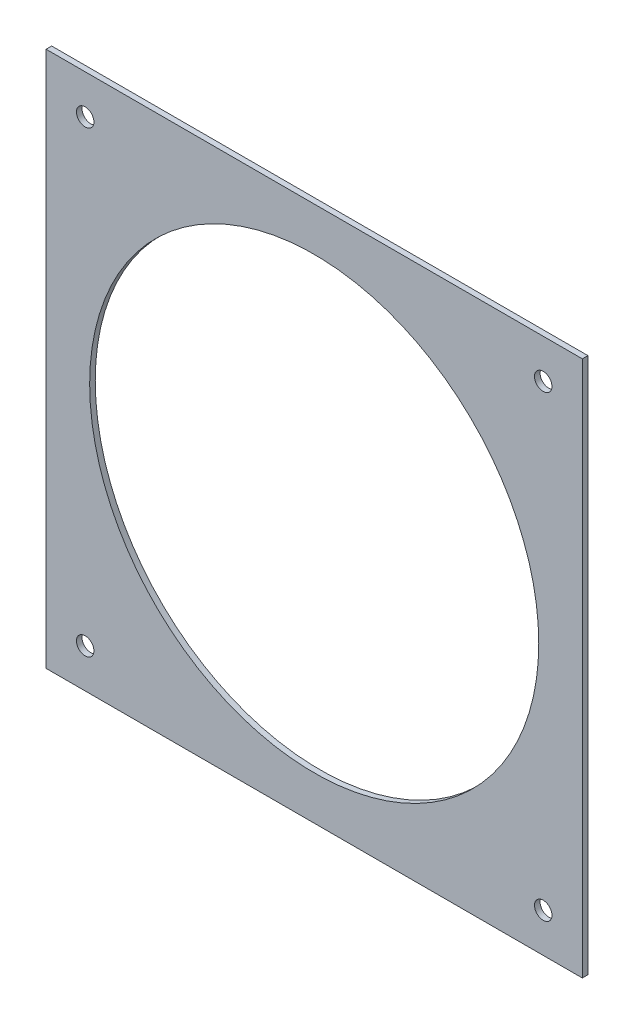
SolidWorks part; units mm, degrees
ref_plane "Front" through (0, 0, 0) normal (0, 0, 1) x (1, 0, 0)
ref_plane "Top" through (0, 0, 0) normal (0, 1, 0) x (1, 0, 0)
ref_plane "Right" through (0, 0, 0) normal (1, 0, 0) x (0, 0, -1)
sketch "Sketch1" plane through (0, 0, 0) normal (0, 0, 1) x (1, 0, 0)
  line L1 (0, 0) -> (304.8, 0)
  line L2 (0, 0) -> (0, 304.8)
  line L3 (0, 304.8) -> (304.8, 304.8)
  line L4 (304.8, 0) -> (304.8, 304.8)
  circle A0 centre (152.4, 152.4) radius 127.635
  dimension "D3" = 255.27
  dimension "D1" = 304.8
  dimension "D2" = 304.8
extrude "Boss-Extrude1" add sketch "Sketch1" along normal blind 3.175
hole_wizard "25/64 (0.39063) Diameter Hole1" positions "Sketch2" profile "Sketch3" hole size "25/64" standard "ANSI Inch"
sketch "Sketch2" plane through (0, 0, 3.175) normal (0, 0, 1) x (1, 0, 0)
  line L0 (0, 304.8) -> (0, 0) construction
  line L1 (0, 0) -> (304.8, 0) construction
  point P0 (22.225, 22.225)
  point P2 (282.575, 22.225)
  point P4 (282.575, 282.575)
  point P6 (22.225, 282.575)
  dimension "D1" = 260.35
  dimension "D2" = 260.35
  dimension "D3" = 22.225
  dimension "D4" = 22.225
sketch "Sketch3" plane through (22.225, 22.225, 3.175) normal (1, 0, 0) x (0, -1, 0)
  line L0 (0, 0) -> (0, 3.175)
  line L1 (0, 3.175) -> (4.961, 3.175)
  line L2 (4.961, 3.175) -> (4.961, 0)
  line L5 (4.961, 0) -> (0, 0)
  line L11 (0, -6.35) -> (0, 107.95) construction
  dimension "Thru Hole Dia." = 9.922
  dimension "Thru Hole Depth" = 3.175
